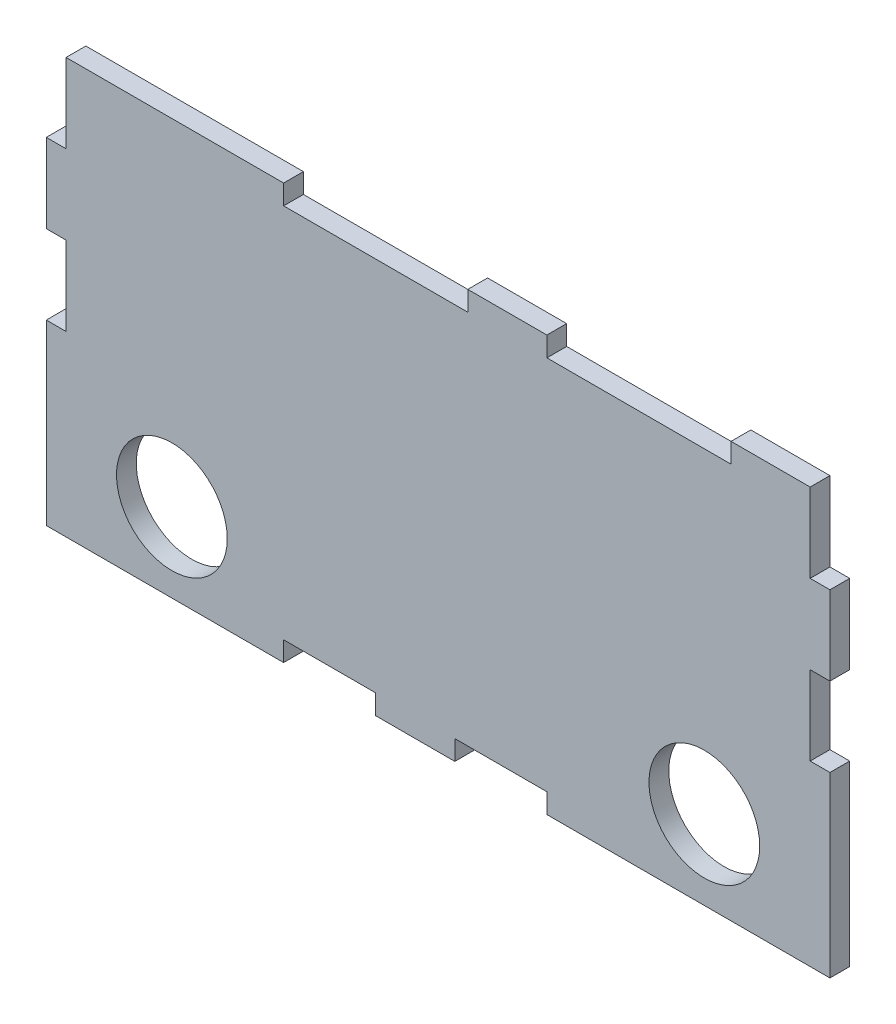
SolidWorks part; units mm, degrees
ref_plane "Front Plane" through (0, 0, 0) normal (0, 0, 1) x (1, 0, 0)
ref_plane "Top Plane" through (0, 0, 0) normal (0, 1, 0) x (1, 0, 0)
ref_plane "Right Plane" through (0, 0, 0) normal (1, 0, 0) x (0, 0, -1)
sketch "Sketch1" plane through (0, 0, 0) normal (0, 0, 1) x (1, 0, 0)
  line L0 (20.8422, 87.9243) -> (34.591, 74.1756) construction
  line L1 (0, 0) -> (198.12, 0) construction
  line L2 (0, 0) -> (0, 105) construction
  line L3 (0, 105) -> (198.12, 105) construction
  line L4 (198.12, 0) -> (198.12, 105) construction
  line L5 (34.591, 74.1756) -> (48.3398, 87.9243) construction
  line L6 (5, 105) -> (5, 0) construction
  line L7 (0, 0) -> (0, 45)
  line L8 (0, 45) -> (5, 45)
  line L9 (5, 45) -> (5, 65)
  line L10 (5, 65) -> (0, 65)
  line L11 (0, 65) -> (0, 85)
  line L12 (0, 85) -> (5, 85)
  line L13 (5, 85) -> (5, 105)
  line L14 (5, 105) -> (60, 105)
  line L15 (60, 105) -> (60, 100)
  line L16 (60, 100) -> (106.56, 100)
  line L17 (106.56, 100) -> (106.56, 105)
  line L18 (106.56, 105) -> (126.56, 105)
  line L19 (126.56, 105) -> (126.56, 100)
  line L20 (126.56, 100) -> (173.12, 100)
  line L21 (173.12, 100) -> (173.12, 105)
  line L22 (173.12, 105) -> (193.12, 105)
  line L23 (193.12, 105) -> (193.12, 85)
  line L24 (193.12, 85) -> (198.12, 85)
  line L25 (198.12, 85) -> (198.12, 65)
  line L26 (198.12, 65) -> (193.12, 65)
  line L27 (193.12, 65) -> (193.12, 45)
  line L28 (193.12, 45) -> (198.12, 45)
  line L29 (198.12, 45) -> (198.12, 0)
  line L30 (0, 0) -> (60, 0)
  line L31 (60, 0) -> (60, 5)
  line L32 (60, 5) -> (83.28, 5)
  line L33 (83.28, 5) -> (83.28, 0)
  line L34 (83.28, 0) -> (103.28, 0)
  line L35 (103.28, 0) -> (103.28, 5)
  line L36 (103.28, 5) -> (126.56, 5)
  line L37 (126.56, 5) -> (126.56, 0)
  line L38 (126.56, 0) -> (198.12, 0)
  circle A0 centre (31.75, 20) radius 14
  circle A1 centre (80.01, 46.3813) radius 14 construction
  circle A2 centre (118.11, 46.3813) radius 14 construction
  circle A3 centre (166.37, 20) radius 14
  circle A4 centre (31.75, 20) radius 55 construction
  circle A5 centre (31.75, 20) radius 31.75 construction
  circle A6 centre (166.37, 20) radius 55 construction
  circle A7 centre (166.37, 20) radius 31.75 construction
  circle A8 centre (31.75, 20) radius 54.25 construction
  circle A9 centre (34.591, 74.1756) radius 19.4437 construction
  circle A10 centre (20.8422, 87.9243) radius 3 construction
  circle A11 centre (20.8422, 60.4268) radius 3 construction
  circle A12 centre (48.3398, 60.4268) radius 3 construction
  circle A13 centre (48.3398, 87.9243) radius 3 construction
  circle A14 centre (34.591, 74.1756) radius 29.591 construction
  circle A15 centre (34.591, 74.1756) radius 13 construction
  dimension "D1" = 63.5
  dimension "D5" = 110
  dimension "D8" = 108.5
  dimension "D9" = 38.8874
  dimension "D10" = 6
  dimension "D11" = 59.182
  dimension "D21" = 26
  dimension "D23" = 28
  dimension "D24" = 28
  dimension "D3" = 38.1
  dimension "D4" = 134.62
  dimension "D6" = 198.12
  dimension "D7" = 105
  dimension "D12" = 20
  dimension "D13" = 5
  dimension "D14" = 20
  dimension "D15" = 20
  dimension "D16" = 45
  dimension "D17" = 20
  dimension "D18" = 20
  dimension "D19" = 55
  dimension "D20" = 5
  dimension "D22" = 20
extrude "Boss-Extrude1" add sketch "Sketch1" along normal blind 5
